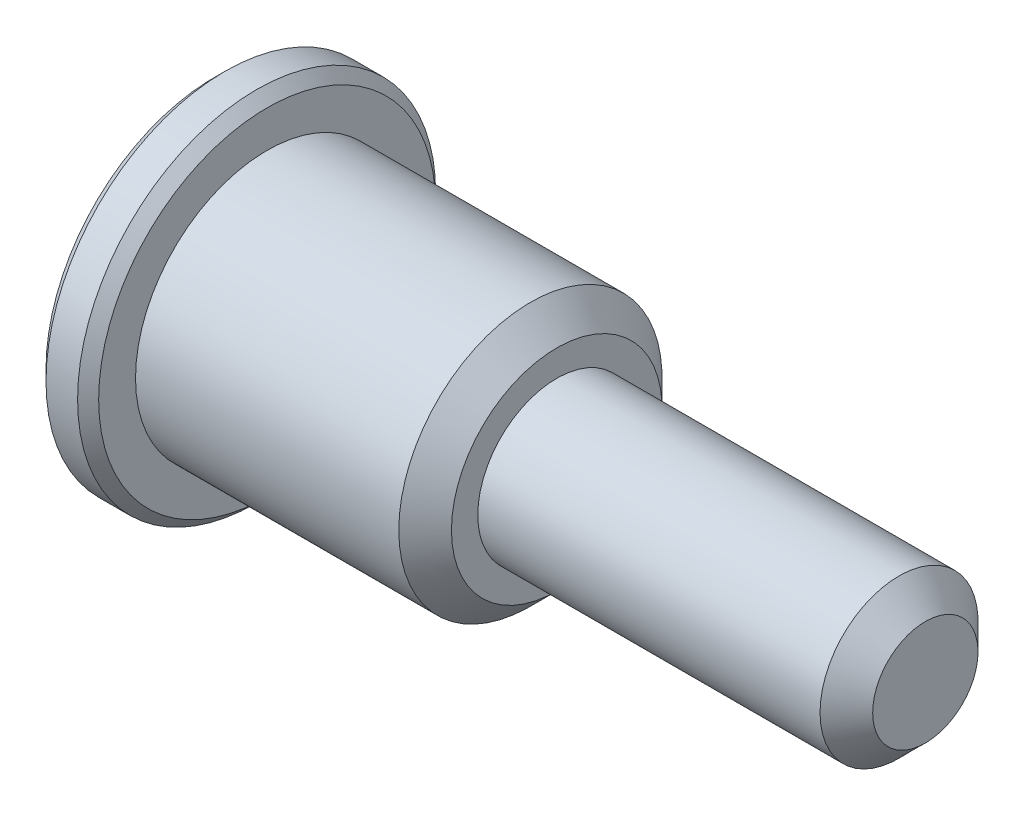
SolidWorks part; units mm, degrees
ref_plane "前视" through (0, 0, 0) normal (0, 0, 1) x (1, 0, 0)
ref_plane "上视" through (0, 0, 0) normal (0, 1, 0) x (1, 0, 0)
ref_plane "右视" through (0, 0, 0) normal (1, 0, 0) x (0, 0, -1)
sketch "草图1" plane through (0, 0, 0) normal (0, 0, 1) x (1, 0, 0)
  line L0 (0, 0) -> (13.1988, 0) construction
  line L1 (0, 0) -> (0, 3.4)
  line L2 (0, 3.4) -> (1, 3.4)
  line L3 (1, 3.4) -> (1, 2.5)
  line L4 (1, 2.5) -> (6.5, 2.5)
  line L5 (6.5, 2.5) -> (6.5, 1.5)
  line L6 (6.5, 1.5) -> (13.5, 1.5)
  line L7 (13.5, 1.5) -> (13.5, 0)
  line L8 (13.5, 0) -> (0, 0)
  dimension "D1" = 6.8
  dimension "D2" = 1
  dimension "D3" = 5
  dimension "D4" = 5.5
  dimension "D5" = 3
  dimension "D6" = 7
revolve "旋转1" add sketch "草图1" angle 360 about L0
chamfer "倒角1" distance 0.5 angle 45 2 edges at (6.5, 0, 2.5) (13.5, 0, 1.5)
chamfer "倒角2" distance 0.2 angle 45 2 edges at (1, 0, 3.4) (0, 0, 3.4)
